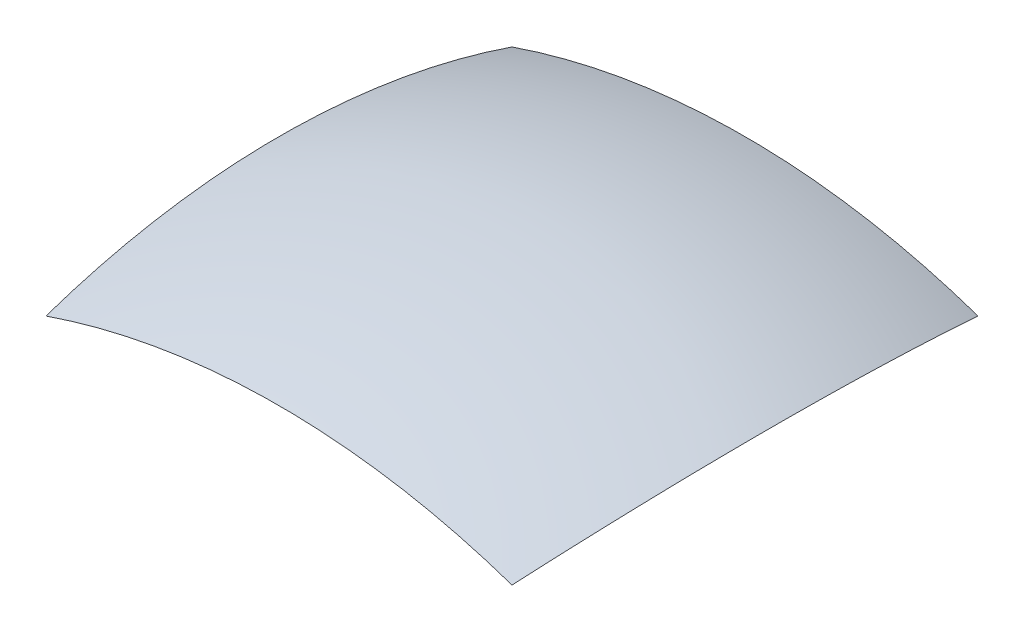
SolidWorks part; units mm, degrees
ref_plane "Front" through (0, 0, 0) normal (0, 0, 1) x (1, 0, 0)
ref_plane "Top" through (0, 0, 0) normal (0, 1, 0) x (1, 0, 0)
ref_plane "Right" through (0, 0, 0) normal (1, 0, 0) x (0, 0, -1)
sketch "Sketch1" plane through (0, 0, 0) normal (0, 0, 1) x (1, 0, 0)
  arc A0 (0, 0) -> (130, 0) centre (65, -189.1428) cw
  dimension "D2" = 200
  dimension "D1" = 130
sketch "Sketch2" plane through (0, 0, 0) normal (1, 0, 0) x (0, 0, -1)
  arc A0 (0, 0) -> (130, 0) centre (65, -189.1428) cw
  dimension "D1" = 200
  dimension "D2" = 130
surface "Surface-Sweep1"
